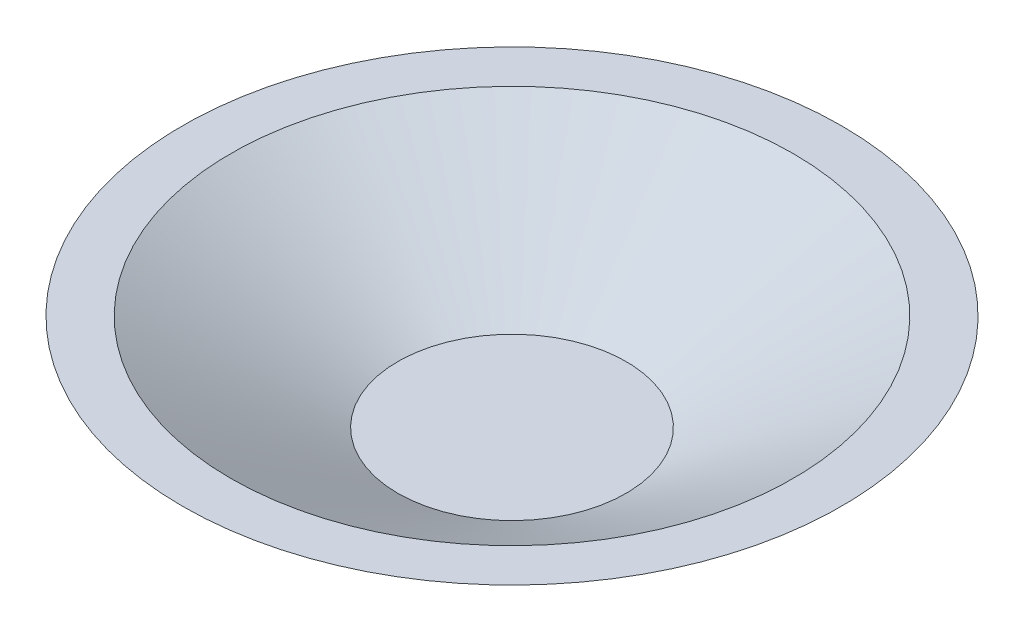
SolidWorks part; units mm, degrees
ref_plane "Face" through (0, 0, 0) normal (0, 0, 1) x (1, 0, 0)
ref_plane "Dessus" through (0, 0, 0) normal (0, 1, 0) x (1, 0, 0)
ref_plane "Droite" through (0, 0, 0) normal (1, 0, 0) x (0, 0, -1)
sketch "Esquisse1" plane through (0, 0, 0) normal (0, 0, 1) x (1, 0, 0)
  line L0 (0, 0) -> (-5, 0)
  line L1 (-5, 0) -> (-13.6603, 5)
  line L2 (-13.6603, 5) -> (0, 5)
  line L3 (0, 0) -> (0, 47.498) construction
  line L4 (0, 0) -> (0, 5)
  dimension "D1" = 5
  dimension "D2" = 5
  dimension "D3" = 150
revolve "Base-Révolution" add sketch "Esquisse1" angle 360 about L3
shell "Coque1" thickness 1
